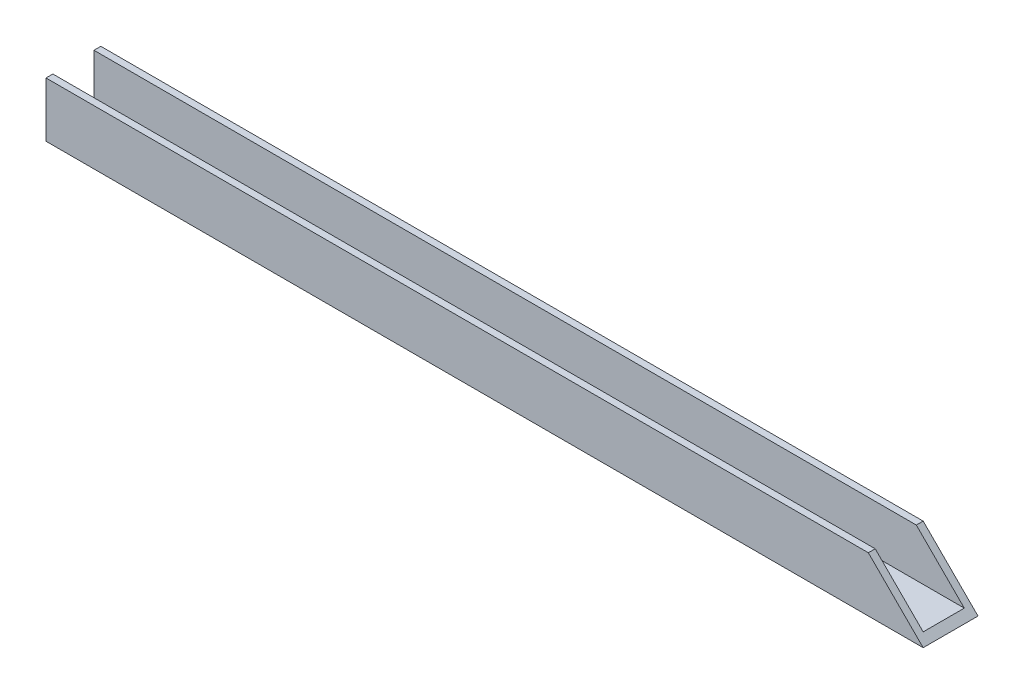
SolidWorks part; units mm, degrees
ref_plane "Front Plane" through (0, 0, 0) normal (0, 0, 1) x (1, 0, 0)
ref_plane "Top Plane" through (0, 0, 0) normal (0, 1, 0) x (1, 0, 0)
ref_plane "Right Plane" through (0, 0, 0) normal (1, 0, 0) x (0, 0, -1)
sketch "Sketch1" plane through (0, 0, 0) normal (1, 0, 0) x (0, 0, -1)
  line L0 (-9.525, 0) -> (9.525, 0)
  line L1 (9.525, 0) -> (9.525, 22.225)
  line L2 (9.525, 22.225) -> (12.7, 22.225)
  line L3 (12.7, 22.225) -> (12.7, -3.175)
  line L4 (12.7, -3.175) -> (-12.7, -3.175)
  line L5 (-12.7, -3.175) -> (-12.7, 22.225)
  line L6 (-12.7, 22.225) -> (-9.525, 22.225)
  line L7 (-9.525, 22.225) -> (-9.525, 0)
  point P7 (0, 0)
  point P10 (0, -3.175)
  dimension "D1" = 3.175
  dimension "D2" = 3.175
  dimension "D3" = 25.4
  dimension "D4" = 25.4
extrude "Boss-Extrude1" add sketch "Sketch1" along normal blind 406.4
sketch "Sketch2" plane through (0, 0, 12.7) normal (0, 0, 1) x (1, 0, 0)
  line L0 (0, -3.175) -> (406.4, -3.175)
  line L1 (406.4, -3.175) -> (381, 22.225)
  line L2 (406.4, 22.225) -> (0, 22.225) construction
  line L3 (381, 22.225) -> (0, 22.225)
  line L4 (0, 22.225) -> (0, -3.175)
  dimension "D1" = 45
extrude "Cut-Extrude1" cut sketch "Sketch2" against normal offset from surface (406.4 mm away) 406.4 flip side to cut
